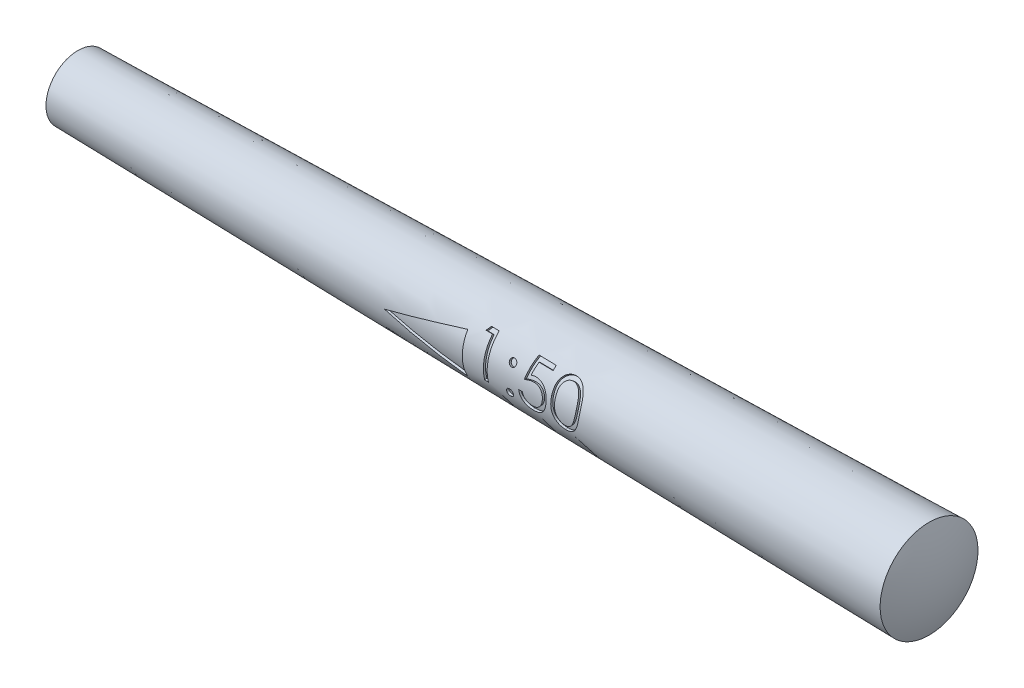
SolidWorks part; units mm, degrees
ref_plane "Front Plane" through (0, 0, 0) normal (0, 0, 1) x (1, 0, 0)
ref_plane "Top Plane" through (0, 0, 0) normal (0, 1, 0) x (1, 0, 0)
ref_plane "Right Plane" through (0, 0, 0) normal (1, 0, 0) x (0, 0, -1)
sketch "Sketch1" plane through (0, 0, 0) normal (1, 0, 0) x (0, 0, -1)
  circle A0 centre (0, 0) radius 0.75
  dimension "D1" = 1.5
extrude "Extrude1" add sketch "Sketch1" along normal mid plane 20
draft "Draft1" type of draft neutral plane draft angle 1.146 faces to draft 1 parameters "D1"=1.146
sketch "Sketch2" plane through (0, 0, 0) normal (0, 0, 1) x (1, 0, 0)
  line L0 (-10, 0) -> (-10, 0.75)
  line L1 (-10, 0.75) -> (-10, -0.75) construction
  line L2 (-10, 0) -> (-10.23, 0)
  line L3 (-10.23, 0) -> (-10.23, -0.95) construction
  line L4 (10, 0) -> (10, 1.15)
  line L5 (10, -1.15) -> (10, 1.15) construction
  line L6 (10, 0) -> (10.23, 0)
  line L7 (10.23, 0) -> (10.23, -0.95) construction
  line L8 (-10, -0.75) -> (10, -1.15) construction
  arc A0 (-10.23, 0) -> (-10, 0.75) centre (-8.8922, 0) cw
  arc A1 (10.23, 0) -> (10, 1.15) centre (7.2399, 0) ccw
  point P14 (0, -0.95)
revolve "Revolve1" add sketch "Sketch2" angle 360 about L2
sketch "Sketch5" plane through (0, 0, 0) normal (0, 0, 1) x (1, 0, 0)
  line L0 (0, 0.95) -> (0, -0.95) construction
  line L1 (10, 1.15) -> (-10, 0.75) construction
  line L2 (-10, -0.75) -> (10, -1.15) construction
ref_plane "Plane2" through (0, 0, 0) normal (-0.02, 0, 0.9998) x (0.9998, 0, 0.02)
sketch "Sketch6" plane through (0, 0, 0) normal (-0.02, 0, 0.9998) x (0.9998, 0, 0.02)
  line L0 (0, 0) -> (0, 0.5)
  line L1 (0, 0.95) -> (0, -0.95) construction
  line L2 (0, 0.5) -> (-1.866, 0)
  line L3 (-1.866, 0) -> (0, -0.5)
  line L4 (0, -0.5) -> (0, 0)
  line L5 (0, -0.25) -> (3, -0.25) construction
  text T0 "1:50" font "Century Gothic" height 1
  dimension "D1" = 1
  dimension "D2" = 30
  dimension "D3" = 3
wrap "Wrap2" sketch "Sketch6" wrap type deboss source sketch "Sketch6" thickness 0.05 parameters "D1"=0.05
equation "\"D2@Sketch2\" = \"D1@Sketch2\""
